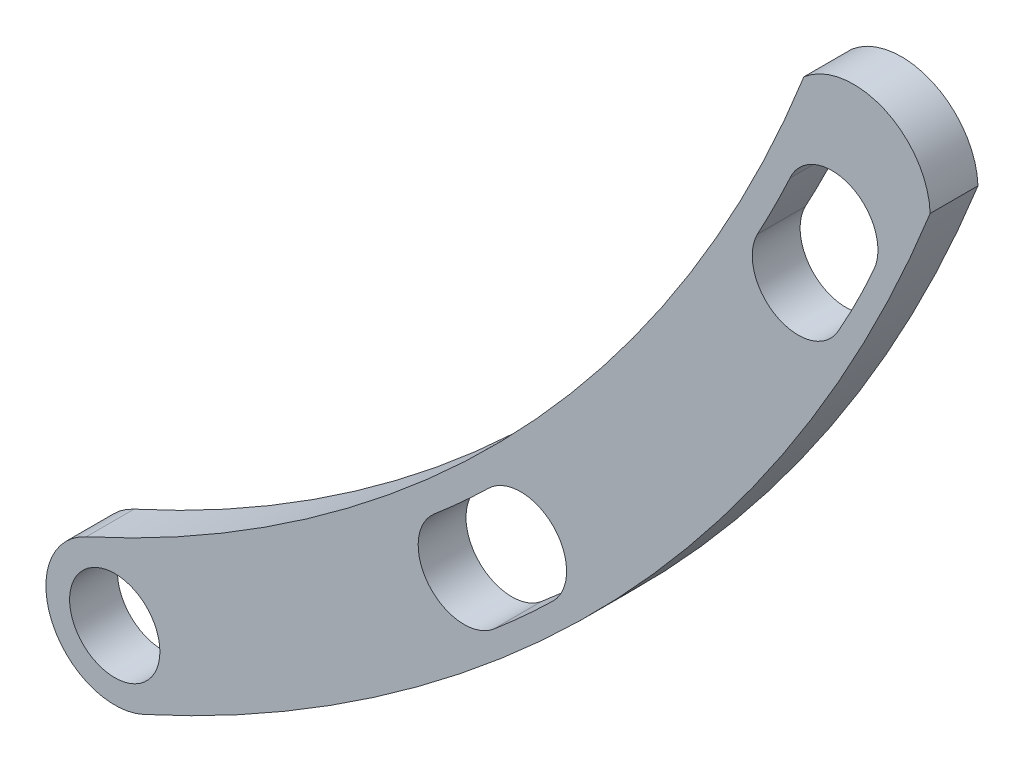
SolidWorks part; units mm, degrees
ref_plane "Front Plane" through (0, 0, 0) normal (0, 0, 1) x (1, 0, 0)
ref_plane "Top Plane" through (0, 0, 0) normal (0, 1, 0) x (1, 0, 0)
ref_plane "Right Plane" through (0, 0, 0) normal (1, 0, 0) x (0, 0, -1)
sketch "Sketch1" plane through (0, 0, 0) normal (0, 0, 1) x (1, 0, 0)
  line L0 (13.97, 18.9379) -> (-13.97, -18.9379) construction
  circle A0 centre (13.97, 18.9379) radius 1.4986
  circle A1 centre (-13.97, -18.9379) radius 1.4986
  arc A2 (16.2376, 18.6486) -> (11.7024, 19.2273) centre (13.97, 18.9379) ccw
  arc A3 (11.7024, 19.2273) -> (-14.9159, -16.8568) centre (-33.9648, 25.0549) cw
  arc A4 (16.2376, 18.6486) -> (-13.0241, -21.0191) centre (-33.9648, 25.0549) cw
  arc A5 (-14.9159, -16.8568) -> (-13.0241, -21.0191) centre (-13.97, -18.9379) ccw
  point P4 (0, 0)
  dimension "D2" = 2.9972
  dimension "D4" = 46.0375
  dimension "D8" = 2.286
  dimension "D1" = 47.0662
  dimension "D3" = 13.97
extrude "Extrude1" add sketch "Sketch1" along normal blind 1.5875
sketch "Sketch3" plane through (0, 0, 1.5875) normal (0, 0, 1) x (1, 0, 0)
  line L0 (3.0833, -2.2744) -> (6.7625, -4.9885) construction
  line L1 (-2.4984, -9.5871) -> (-0.4203, -11.8169) construction
  line L3 (10.6148, 2.7516) -> (7.8887, 4.115) construction
  arc A1 (13.97, 18.9379) -> (-13.97, -18.9379) centre (-33.9648, 25.0549) cw construction
  arc A2 (-14.9159, -16.8568) -> (11.7024, 19.2273) centre (-33.9648, 25.0549) ccw construction
  arc A3 (-13.0241, -21.0191) -> (16.2376, 18.6486) centre (-33.9648, 25.0549) ccw construction
  circle A4 centre (9.2517, 3.4333) radius 1.524
  circle A5 centre (-1.4593, -10.702) radius 1.524
  point P15 (4.9229, -3.6315)
  point P16 (-1.4593, -10.702)
  point P26 (9.2517, 3.4333)
  dimension "D1" = 9.525
  dimension "D4" = 8.255
  dimension "D5" = 3.048
extrude "Cut-Extrude1" [suppressed] cut sketch "Sketch3" against normal blind 6.35
sketch "Sketch5" plane through (0, 0, 1.5875) normal (0, 0, 1) x (1, 0, 0)
  line L0 (3.0833, -2.2744) -> (6.7625, -4.9885) construction
  line L1 (7.1943, 4.43) -> (11.2818, 2.3818) construction
  line L2 (-2.9832, -8.9979) -> (0.0645, -12.4061) construction
  line L4 (11.2367, 3.9139) -> (8.4436, 5.1343) construction
  line L5 (10.0424, 1.5283) -> (7.363, 2.9801) construction
  line L6 (0.5687, -10.9673) -> (-1.558, -8.7839) construction
  line L7 (-1.3878, -12.7459) -> (-3.3592, -10.4213) construction
  arc A0 (0.5687, -10.9673) -> (-1.558, -8.7839) centre (-0.4947, -9.8756) ccw
  arc A1 (-14.9159, -16.8568) -> (11.7024, 19.2273) centre (-33.9648, 25.0549) ccw construction
  arc A2 (-13.0241, -21.0191) -> (16.2376, 18.6486) centre (-33.9648, 25.0549) ccw construction
  arc A3 (14.2594, 21.2056) -> (-16.0511, -19.8838) centre (-33.9648, 25.0549) cw construction
  arc A4 (16.2376, 18.6486) -> (11.7024, 19.2273) centre (13.97, 18.9379) ccw construction
  arc A5 (-3.3592, -10.4213) -> (-1.3878, -12.7459) centre (-2.3735, -11.5836) ccw
  arc A6 (-14.9159, -16.8568) -> (-13.0241, -21.0191) centre (-13.97, -18.9379) ccw construction
  arc A7 (-3.3592, -10.4213) -> (-1.558, -8.7839) centre (-26.2308, 16.5473) ccw
  arc A8 (0.5687, -10.9673) -> (-1.3878, -12.7459) centre (-26.2308, 16.5473) cw
  arc A9 (8.4436, 5.1343) -> (11.2367, 3.9139) centre (9.8402, 4.5241) cw
  arc A10 (11.2367, 3.9139) -> (10.0424, 1.5283) centre (-12.1898, 14.1499) cw
  arc A11 (10.0424, 1.5283) -> (7.363, 2.9801) centre (8.7171, 2.2807) cw
  arc A12 (7.363, 2.9801) -> (8.4436, 5.1343) centre (-26.1801, 21.1546) ccw
  point P13 (9.238, 3.4059)
  point P14 (4.9229, -3.6315)
  point P15 (-1.4593, -10.702)
  point P26 (9.8402, 4.5241)
  point P29 (8.7027, 2.2542)
  point P35 (-0.4947, -9.8756)
  point P36 (-2.3735, -11.5836)
  dimension "D3" = 1.27
  dimension "D5" = 1.27
  dimension "D1" = 8.255
  dimension "D2" = 9.525
  dimension "D4" = 1.27
  dimension "D6" = 1.27
extrude "Adjustment Slots" cut sketch "Sketch5" against normal through all
sketch "Sketch4" plane through (0, 0, 1.5875) normal (0, 0, 1) x (1, 0, 0)
  arc A0 (13.0991, 6.4455) -> (8.9068, 8.2775) centre (10.5609, 6.35) ccw
  arc A1 (-13.0241, -21.0191) -> (16.2376, 18.6486) centre (-33.9648, 25.0549) ccw construction
  arc A2 (-14.9159, -16.8568) -> (11.7024, 19.2273) centre (-33.9648, 25.0549) ccw construction
  dimension "D1" = 2.54
  dimension "D2" = 6.35
extrude "Cut-Extrude2" cut sketch "Sketch4" against normal through all flip side to cut
